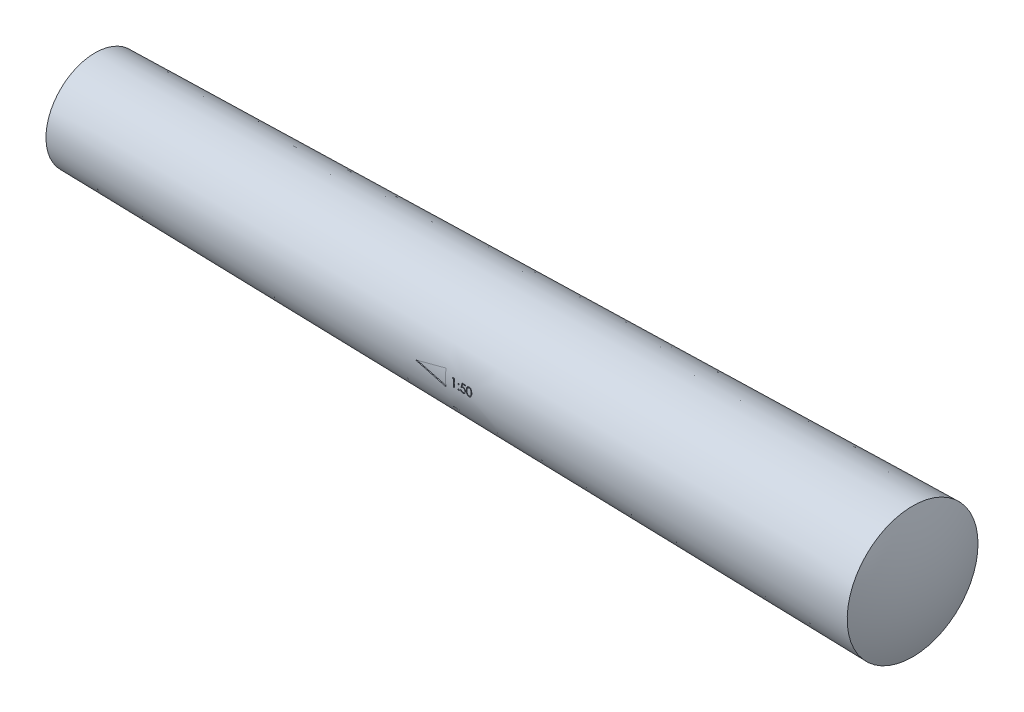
SolidWorks part; units mm, degrees
ref_plane "Front Plane" through (0, 0, 0) normal (0, 0, 1) x (1, 0, 0)
ref_plane "Top Plane" through (0, 0, 0) normal (0, 1, 0) x (1, 0, 0)
ref_plane "Right Plane" through (0, 0, 0) normal (1, 0, 0) x (0, 0, -1)
sketch "Sketch1" plane through (0, 0, 0) normal (1, 0, 0) x (0, 0, -1)
  circle A0 centre (0, 0) radius 6
  dimension "D1" = 12
extrude "Extrude1" add sketch "Sketch1" along normal mid plane 100
draft "Draft1" type of draft neutral plane draft angle 1.146 faces to draft 1 parameters "D1"=1.146
sketch "Sketch2" plane through (0, 0, 0) normal (0, 0, 1) x (1, 0, 0)
  line L0 (-50, 0) -> (-50, 6)
  line L1 (-50, 6) -> (-50, -6) construction
  line L2 (-50, 0) -> (-51.6, 0)
  line L3 (-51.6, 0) -> (-51.6, -7) construction
  line L4 (50, 0) -> (50, 8.0001)
  line L5 (50, -8.0001) -> (50, 8.0001) construction
  line L6 (50, 0) -> (51.6, 0)
  line L7 (51.6, 0) -> (51.6, -7) construction
  line L8 (-50, -6) -> (50, -8.0001) construction
  arc A0 (-51.6, 0) -> (-50, 6) centre (-39.55, 0) cw
  arc A1 (51.6, 0) -> (50, 8.0001) centre (30.7997, 0) ccw
  point P14 (0, -7)
revolve "Revolve1" add sketch "Sketch2" angle 360 about L2
sketch "Sketch5" plane through (0, 0, 0) normal (0, 0, 1) x (1, 0, 0)
  line L0 (0, 7) -> (0, -7) construction
  line L1 (50, 8.0001) -> (-50, 6) construction
  line L2 (-50, -6) -> (50, -8.0001) construction
ref_plane "Plane2" through (0, 0, 0) normal (-0.02, 0, 0.9998) x (0.9998, 0, 0.02)
sketch "Sketch6" plane through (0, 0, 0) normal (-0.02, 0, 0.9998) x (0.9998, 0, 0.02)
  line L0 (0, 0) -> (0, 1)
  line L1 (0, 7) -> (0, -7) construction
  line L2 (0, 1) -> (-3.7321, 0)
  line L3 (-3.7321, 0) -> (0, -1)
  line L4 (0, -1) -> (0, 0)
  line L5 (0, -0.5) -> (4, -0.5) construction
  text T0 "1:50" font "Century Gothic" height 1
  dimension "D1" = 2
  dimension "D2" = 30
  dimension "D3" = 4
wrap "Wrap2" sketch "Sketch6" wrap type deboss source sketch "Sketch6" thickness 0.1 parameters "D1"=0.1
equation "\"D2@Sketch2\" = \"D1@Sketch2\""
